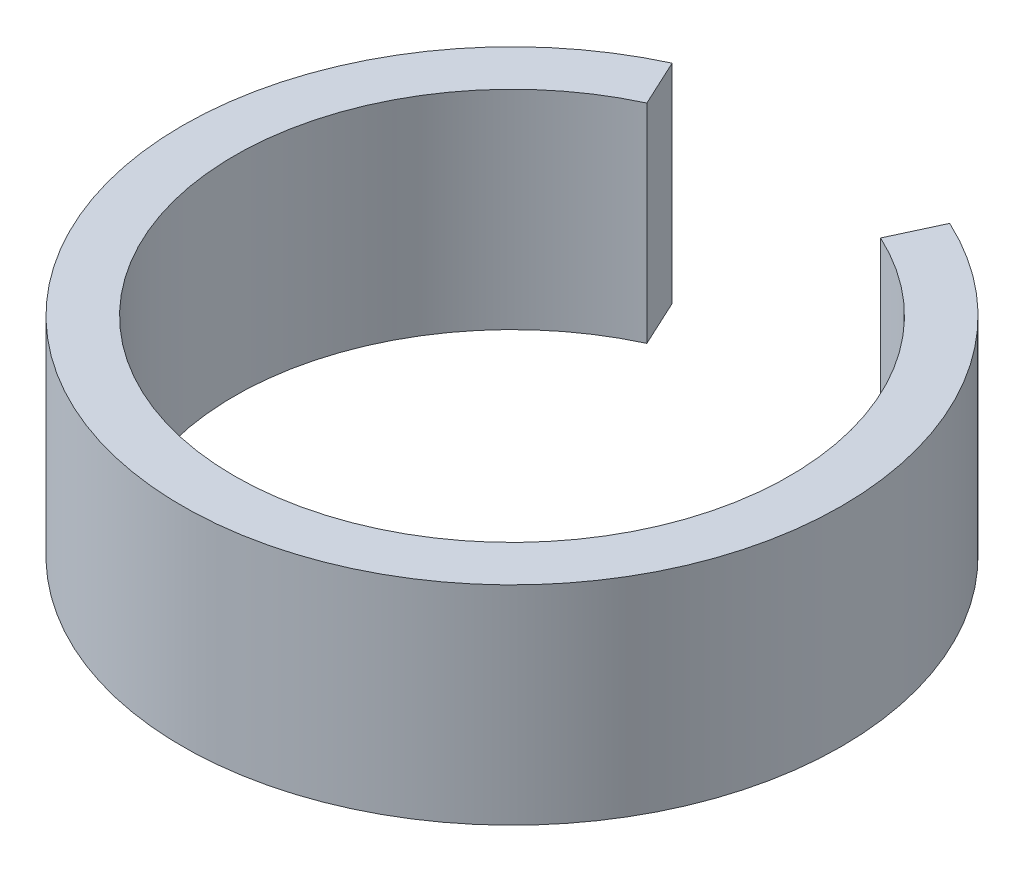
SolidWorks part; units mm, degrees
ref_plane "Front Plane" through (0, 0, 0) normal (0, 0, 1) x (1, 0, 0)
ref_plane "Top Plane" through (0, 0, 0) normal (0, 1, 0) x (1, 0, 0)
ref_plane "Right Plane" through (0, 0, 0) normal (1, 0, 0) x (0, 0, -1)
sketch "Sketch1" plane through (0, 0, 0) normal (0, 1, 0) x (1, 0, 0)
  line L0 (2, 4.3084) -> (1.6842, 3.6281)
  line L1 (-2, 4.3084) -> (-1.6842, 3.6281)
  arc A0 (-2, 4.3084) -> (2, 4.3084) centre (0, 0) ccw
  arc A1 (-1.6842, 3.6281) -> (1.6842, 3.6281) centre (0, 0) ccw
  dimension "D1" = 4.75
  dimension "D2" = 4
  dimension "D3" = 4
extrude "Boss-Extrude1" add sketch "Sketch1" along normal blind 3
equation "\"CirclipH\"= 3"
equation "\"CirclipDMin\"=8.000000"
equation "\"CirclipDMaj\"= 9.5"
equation "\"D1@Sketch1\" = \"CirclipDMaj\"/2"
equation "\"D2@Sketch1\" = \"CirclipDMin\"/2"
